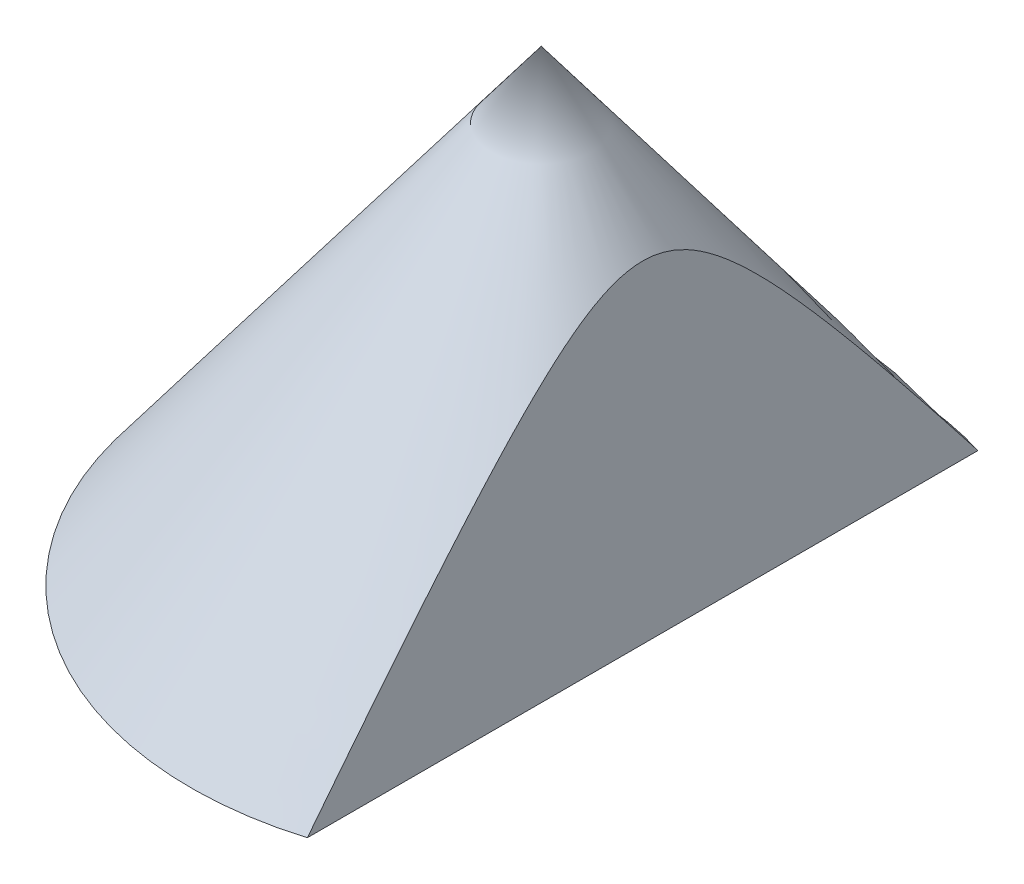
SolidWorks part; units mm, degrees
ref_plane "前视基准面" through (0, 0, 0) normal (0, 0, 1) x (1, 0, 0)
ref_plane "上视基准面" through (0, 0, 0) normal (0, 1, 0) x (1, 0, 0)
ref_plane "右视基准面" through (0, 0, 0) normal (1, 0, 0) x (0, 0, -1)
sketch "草图1" plane through (0, 0, 0) normal (1, 0, 0) x (0, 0, -1)
  line L0 (0, 0) -> (0, 61.5517) construction
  line L1 (0, 12.931) -> (60, 12.931)
  line L2 (60, 12.931) -> (0, 92.931)
  line L3 (0, 92.931) -> (0, 12.931)
  dimension "D1" = 60
  dimension "D2" = 80
revolve "旋转1" add sketch "草图1" angle 360 about L0
sketch "草图2" plane through (0, 0, 0) normal (0, 0, 1) x (1, 0, 0)
  line L0 (17.3715, 69.7691) -> (17.3715, 12.931)
  line L1 (60, 12.931) -> (0, 92.931) construction
  line L2 (-60, 12.931) -> (60, 12.931) construction
  line L3 (17.3715, 12.931) -> (66.4544, 8.2044)
  line L4 (66.4544, 8.2044) -> (68.0554, 94.2557)
  line L5 (68.0554, 94.2557) -> (17.3715, 69.7691)
  point P6 (30.9907, 12.931)
extrude "切除-拉伸1" cut sketch "草图2" against normal through all both and the other way through all
